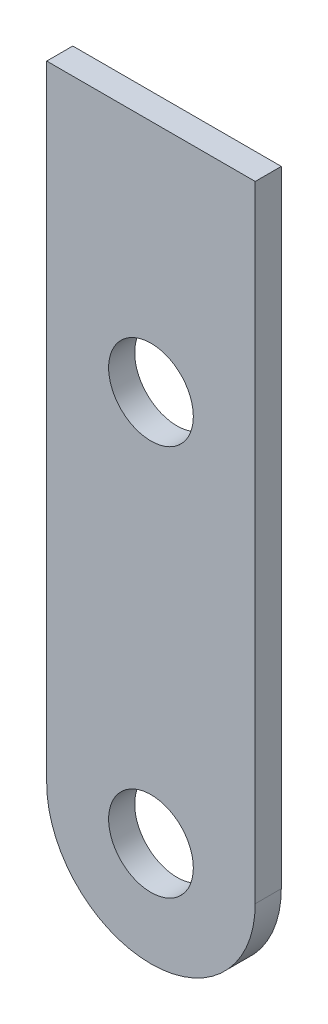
SolidWorks part; units mm, degrees
ref_plane "Front Plane" through (0, 0, 0) normal (0, 0, 1) x (1, 0, 0)
ref_plane "Top Plane" through (0, 0, 0) normal (0, 1, 0) x (1, 0, 0)
ref_plane "Right Plane" through (0, 0, 0) normal (1, 0, 0) x (0, 0, -1)
sketch "Sketch1" plane through (0, 0, 0) normal (0, 0, 1) x (1, 0, 0)
  line L0 (0, 0) -> (0, -152.4)
  line L1 (50.8, -152.4) -> (50.8, 0)
  line L2 (50.8, 0) -> (0, 0)
  arc A0 (0, -152.4) -> (50.8, -152.4) centre (25.4, -152.4) ccw
  circle A1 centre (25.4, -152.4) radius 10.3187
  circle A2 centre (25.4, -57.15) radius 10.3187
  point P10 (25.4, 0)
  dimension "D1" = 20.6375
  dimension "D2" = 95.25
  dimension "D4" = 50.8
  dimension "D3" = 152.4
extrude "Boss-Extrude1" add sketch "Sketch1" along normal blind 6.35
